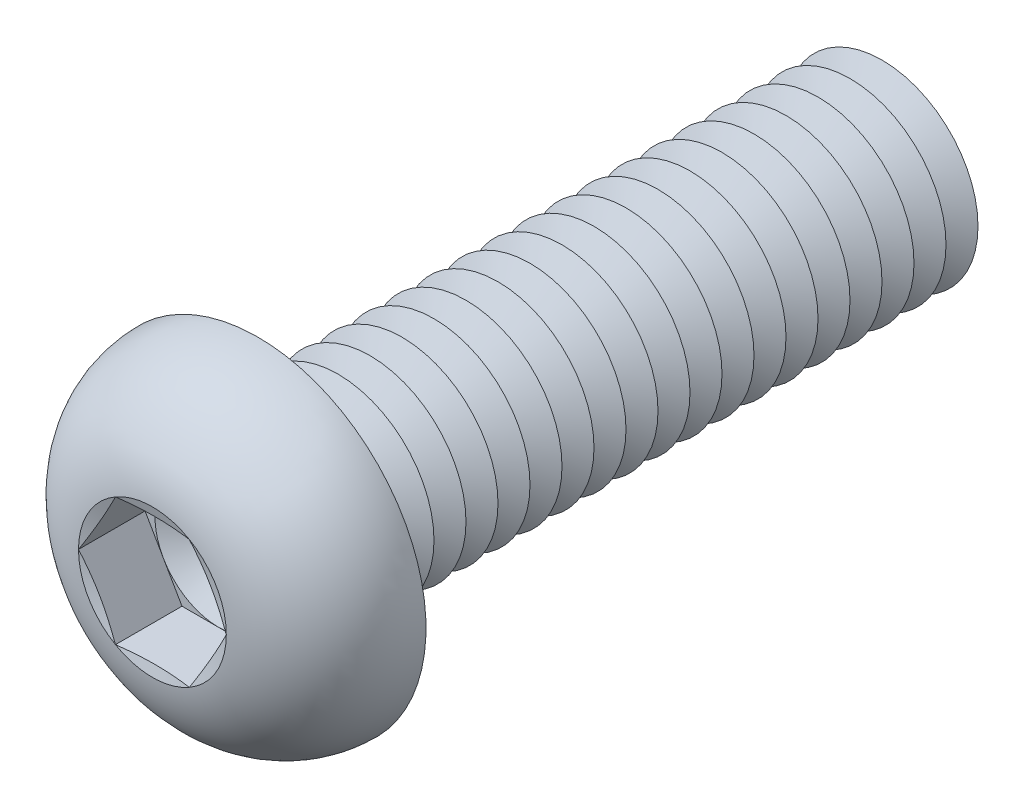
SolidWorks part; units mm, degrees
ref_plane "Front Plane" through (0, 0, 0) normal (0, 0, 1) x (1, 0, 0)
ref_plane "Top Plane" through (0, 0, 0) normal (0, 1, 0) x (1, 0, 0)
ref_plane "Right Plane" through (0, 0, 0) normal (1, 0, 0) x (0, 0, -1)
sketch "Sketch1" plane through (0, 0, 0) normal (1, 0, 0) x (0, 0, -1)
  line L0 (0, 3) -> (0, 5.25)
  line L3 (0, 3) -> (20, 3)
  line L4 (20, 3) -> (20, 0)
  line L5 (20, 0) -> (-3.3, 0) construction
  line L6 (-3.3, 0) -> (20, 0)
  line L7 (-3.3, 2.3094) -> (-3.3, 1.1547) construction
  line L8 (-3.3, 1.1547) -> (-3.3, 0)
  line L9 (-3.3, 2.3094) -> (-2.9906, 1.1547)
  line L10 (-2.9906, 1.1547) -> (-3.3, 1.1547)
  line L11 (20, 0) -> (22.7481, 0) construction
  line L12 (0, 5.25) -> (-3.3, 5.25) construction
  arc A1 (0, 5.25) -> (-3.3, 2.3094) centre (0, 1.928) ccw
  point P8 (20, 1.5)
  dimension "D1" = 10.5
  dimension "D2" = 6
  dimension "D3" = 3.3
  dimension "D4" = 4.6188
  dimension "D5" = 20
  dimension "D6" = 15
revolve "Revolve1" add sketch "Sketch1" angle 360 about L5
fillet "Fillet1" radius 0.5 1 edges at (-3, 0, 0)
sketch "Sketch2" plane through (0, 0, 0) normal (1, 0, 0) x (0, 0, -1)
  line L0 (19.5, 3) -> (20.5, 3)
  line L1 (20, 3) -> (0.5, 3) construction
  line L2 (20.5, 3) -> (20, 2.134)
  line L3 (20, -3) -> (20, 3) construction
  line L4 (20, 2.134) -> (19.5, 3)
  dimension "D1" = 1
revolve "Cut-Revolve1" cut sketch "Sketch2" angle 360 about axis through (0, 0, -20) along (0, 0, -1)
pattern_linear "LPattern1" count 20 spacing 1 along (0, 0, 1) of "Cut-Revolve1"
sketch "Sketch3" plane through (0, 0, 3.3) normal (0, 0, 1) x (1, 0, 0)
  line L7 (1.1547, 2) -> (-1.1547, 2)
  line L8 (-1.1547, 2) -> (-2.3094, 0)
  line L9 (-2.3094, 0) -> (-1.1547, -2)
  line L10 (-1.1547, -2) -> (1.1547, -2)
  line L11 (1.1547, -2) -> (2.3094, 0)
  line L12 (2.3094, 0) -> (1.1547, 2)
  circle A0 centre (0, 0) radius 2 construction
  circle A3 centre (0, 0) radius 2.3094 construction
extrude "Cut-Extrude1" cut sketch "Sketch3" against normal blind 2.08
sketch "Sketch4" plane through (0, 0, 1.22) normal (0, 0, 1) x (1, 0, 0)
  line L1 (1.1547, 2) -> (-1.1547, 2) construction
  circle A0 centre (0, 0) radius 2
extrude "Cut-Extrude2" cut sketch "Sketch4" against normal through all draft 60
